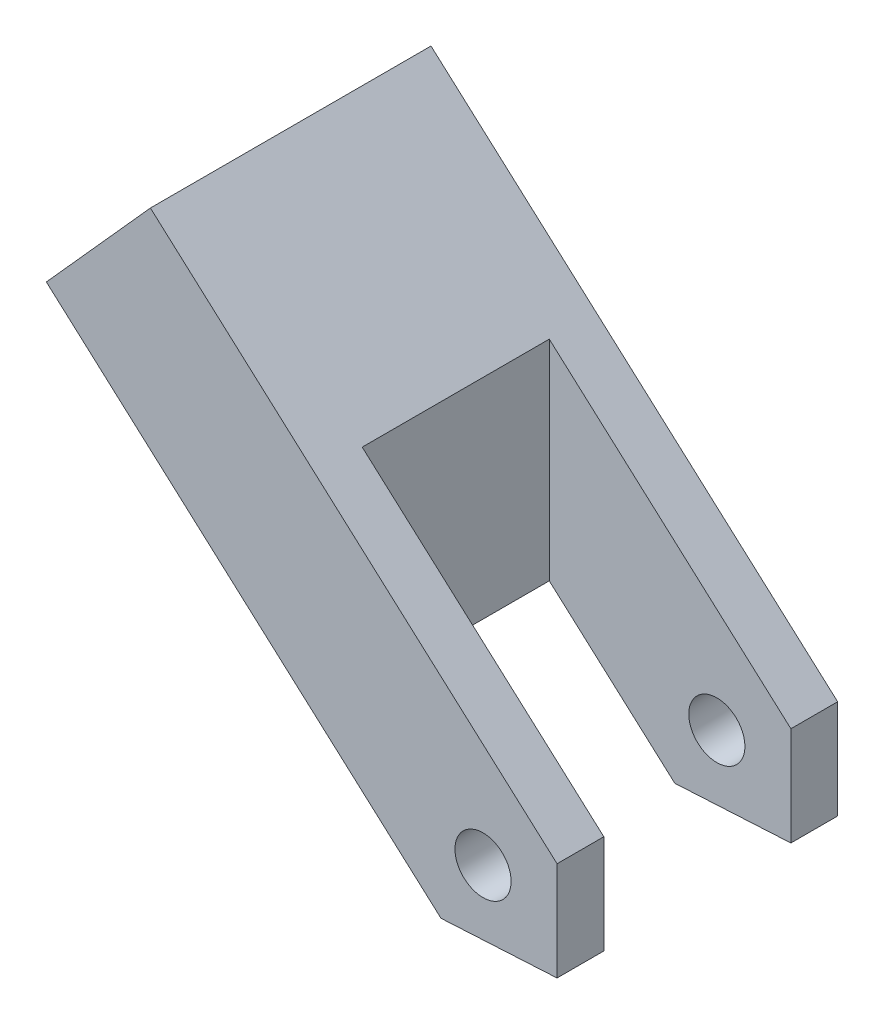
SolidWorks part; units mm, degrees
ref_plane "Front Plane" through (0, 0, 0) normal (0, 0, 1) x (1, 0, 0)
ref_plane "Top Plane" through (0, 0, 0) normal (0, 1, 0) x (1, 0, 0)
ref_plane "Right Plane" through (0, 0, 0) normal (1, 0, 0) x (0, 0, -1)
sketch "Sketch2" plane through (0, 0, 0) normal (0, 0, 1) x (1, 0, 0)
  line L0 (0, 0) -> (16.3816, -14.6848)
  line L3 (3.3375, 3.7231) -> (0, 0)
  line L4 (16.3816, -14.6848) -> (16.3816, -7.97)
  line L5 (16.3816, -7.97) -> (3.3375, 3.7231)
  dimension "D1" = 5
  dimension "D2" = 22
  dimension "D3" = 3.3375
extrude "Boss-Extrude2" add sketch "Sketch2" along normal blind 9
sketch "Sketch3" plane through (0, 0, 0) normal (0, 1, 0) x (1, 0, 0)
  line L0 (16.3816, -9) -> (16.3816, 0) construction
  line L1 (16.3816, -1.5) -> (8.6316, -1.5)
  line L2 (16.3816, -1.5) -> (16.3816, -7.5)
  line L3 (16.3816, -7.5) -> (8.6316, -7.5)
  line L4 (8.6316, -1.5) -> (8.6316, -7.5)
  line L5 (0, -4.5) -> (50000, -4.5) construction
  line L6 (0, -9) -> (0, 0) construction
  point P10 (0, -4.5)
  point P11 (8.6316, -4.5)
  dimension "D1" = 6
  dimension "D2" = 7.75
extrude "Cut-Extrude1" cut sketch "Sketch3" against normal through all
sketch "Sketch4" plane through (0, 0, 0) normal (0, 0, 1) x (1, 0, 0)
  line L0 (16.3816, -14.6848) -> (16.3816, -7.97) construction
  line L1 (12.3378, -11.0599) -> (15.6753, -7.3369) construction
  line L2 (0, 0) -> (16.3816, -14.6848) construction
  line L3 (16.3816, -7.97) -> (3.3375, 3.7231) construction
  circle A0 centre (14.0066, -9.1984) radius 0.9
  point P2 (14.0066, -9.1984)
  point P5 (12.813, -11.4859)
  point P6 (0, 0)
  point P14 (0, 0)
  point P15 (0, 0)
  dimension "D1" = 1.8
  dimension "D2" = 2.375
  dimension "D4" = 2.375
extrude "Cut-Extrude2" cut sketch "Sketch4" along normal through all
chamfer "Chamfer1" distance 5 angle 45 2 edges at (16.3816, -14.6848, 0.75) (16.3816, -14.6848, 8.25)
